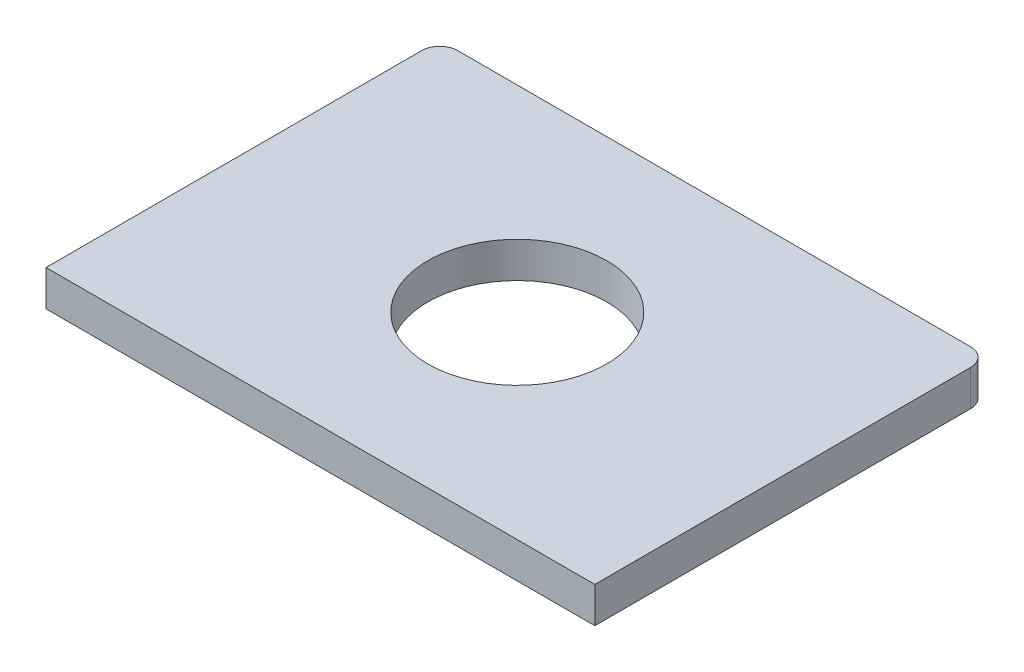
SolidWorks part; units mm, degrees
ref_plane "Plan de face" through (0, 0, 0) normal (0, 0, 1) x (1, 0, 0)
ref_plane "Plan de dessus" through (0, 0, 0) normal (0, 1, 0) x (1, 0, 0)
ref_plane "Plan de droite" through (0, 0, 0) normal (1, 0, 0) x (0, 0, -1)
sketch "Esquisse1" plane through (0, 0, 0) normal (0, 1, 0) x (1, 0, 0)
  circle A0 centre (0, 0) radius 75
  circle A1 centre (0, 0) radius 60
  dimension "D1" = 150
  dimension "D2" = 120
extrude "Boss.-Extru.1" add sketch "Esquisse1" along normal blind 215
sketch "Esquisse2" plane through (0, 215, 0) normal (0, 1, 0) x (1, 0, 0)
  line L0 (142.683, 135) -> (-142.683, 135)
  line L1 (-200, 0) -> (-230, -26.0577)
  line L2 (-230, -26.0577) -> (-230, -165)
  line L3 (-230, -165) -> (-200, -165)
  line L4 (200, 0) -> (230, -32.3018)
  line L5 (230, -32.3018) -> (230, -165)
  line L6 (230, -165) -> (200, -165)
  line L7 (142.683, 135) -> (47.6326, 57.9321)
  line L9 (170, 118.5267) -> (66.5267, 34.6295)
  line L10 (-200, 165) -> (-200, 0)
  line L11 (200, -165) -> (-200, -165)
  line L12 (200, 165) -> (200, 0)
  line L13 (200, 165) -> (-200, 165)
  line L14 (-170, 118.5267) -> (-170, -118.5267)
  line L15 (142.683, -135) -> (-142.683, -135)
  line L16 (170, 118.5267) -> (170, -118.5267)
  line L17 (170, 135) -> (166.5, 135)
  line L18 (-47.6326, -57.9321) -> (-142.683, -135)
  line L20 (142.683, -135) -> (47.6326, -57.9321)
  line L22 (-66.5267, -34.6295) -> (-170, -118.5267)
  line L24 (-66.5267, 34.6295) -> (-170, 118.5267)
  line L28 (-47.6326, 57.9321) -> (-142.683, 135)
  line L30 (170, -118.5267) -> (66.5267, -34.6295)
  circle A0 centre (0, 0) radius 75
  point P0 (0, 0)
  dimension "D1" = 30
  dimension "D2" = 30
extrude "Boss.-Extru.2" add sketch "Esquisse2" along normal blind 30 separate body
sketch "Esquisse3" plane through (0, 215, 0) normal (0, 1, 0) x (1, 0, 0)
  circle A0 centre (0, 0) radius 75
extrude "Boss.-Extru.3" add sketch "Esquisse3" along normal blind 30
sketch "Esquisse4" plane through (0, 245, 0) normal (0, 1, 0) x (1, 0, 0)
  circle A0 centre (0, 0) radius 75
extrude "Enlèv. mat.-Extru.2" cut sketch "Esquisse4" against normal blind 305
sketch "Esquisse5" plane through (0, 0, 165) normal (0, 0, 1) x (1, 0, 0)
  line L0 (-230, 245) -> (-230, 215) construction
  line L1 (-207, 240) -> (-223, 240)
  line L2 (-205, 238) -> (-205, 222)
  line L3 (-207, 220) -> (-223, 220)
  line L4 (-225, 238) -> (-225, 222)
  line L5 (-205, 240) -> (-225, 220) construction
  line L6 (-205, 220) -> (-225, 240) construction
  line L7 (-230, 245) -> (230, 245) construction
  line L8 (230, 245) -> (230, 215) construction
  line L9 (207, 240) -> (223, 240)
  line L10 (205, 238) -> (205, 222)
  line L11 (207, 220) -> (223, 220)
  line L12 (225, 238) -> (225, 222)
  line L13 (205, 240) -> (225, 220) construction
  line L14 (205, 220) -> (225, 240) construction
  arc A0 (-223, 240) -> (-225, 238) centre (-223, 238) ccw
  arc A1 (-223, 220) -> (-225, 222) centre (-223, 222) cw
  arc A2 (-205, 222) -> (-207, 220) centre (-207, 222) cw
  arc A3 (-207, 240) -> (-205, 238) centre (-207, 238) cw
  arc A4 (205, 222) -> (207, 220) centre (207, 222) ccw
  arc A5 (223, 220) -> (225, 222) centre (223, 222) ccw
  arc A6 (223, 240) -> (225, 238) centre (223, 238) cw
  arc A7 (207, 240) -> (205, 238) centre (207, 238) ccw
  point P0 (-215, 230)
  point P9 (215, 230)
  dimension "D9" = 2
  dimension "D1" = 20
  dimension "D2" = 20
  dimension "D3" = 5
  dimension "D4" = 5
  dimension "D5" = 20
  dimension "D6" = 20
  dimension "D7" = 5
  dimension "D8" = 5
extrude "Enlèv. mat.-Extru.3" cut sketch "Esquisse5" against normal blind 80
shell "Coque1" thickness 5
sketch "Esquisse8" plane through (0, 0, 80) normal (0, 0, -1) x (-1, 0, 0)
  line L1 (-225, 240) -> (-199.9468, 240)
  line L2 (-225, 240) -> (-225, 220.0305)
  line L3 (-225, 220.0305) -> (-199.9468, 220.0305)
  line L4 (-199.9468, 240) -> (-199.9468, 220.0305)
extrude "Enlèv. mat.-Extru.4" cut sketch "Esquisse8" against normal blind 80
sketch "Esquisse9" plane through (0, 0, 85) normal (0, 0, -1) x (-1, 0, 0)
  line L0 (207, 240) -> (200.2918, 240) construction
  line L1 (207, 240) -> (199.8445, 240)
  line L2 (207, 240) -> (207, 220)
  line L3 (207, 220) -> (199.8445, 220)
  line L4 (199.8445, 240) -> (199.8445, 220)
  arc A0 (207, 240) -> (205, 238) centre (207, 238) ccw construction
extrude "Enlèv. mat.-Extru.5" cut sketch "Esquisse9" against normal blind 75
sketch "Esquisse10" plane through (0, 245, 0) normal (0, 1, 0) x (1, 0, 0)
  line L0 (230, -32.3018) -> (230, -165) construction
  line L1 (-230, -165) -> (230, -165)
  line L2 (-230, -165) -> (-230, 165)
  line L3 (-230, 165) -> (230, 165)
  line L4 (230, -165) -> (230, 165)
  line L5 (200, 165) -> (-200, 165) construction
  dimension "D1" = 0
  dimension "D2" = 0
extrude "Boss.-Extru.4" add sketch "Esquisse10" against normal blind 30
sketch "Esquisse11" plane through (0, 245, 0) normal (0, 1, 0) x (1, 0, 0)
  circle A0 centre (0, 0) radius 75
  dimension "D1" = 150
extrude "Enlèv. mat.-Extru.6" cut sketch "Esquisse11" against normal blind 30
sketch "Esquisse12" plane through (0, 0, 165) normal (0, 0, 1) x (1, 0, 0)
  line L0 (-230, 245) -> (230, 245) construction
  line L1 (-225, 240) -> (225, 240)
  line L2 (-225, 240) -> (-225, 220)
  line L3 (-225, 220) -> (225, 220)
  line L4 (225, 240) -> (225, 220)
  line L5 (-230, 245) -> (-230, 215) construction
  line L6 (-230, 215) -> (230, 215) construction
  line L7 (230, 245) -> (230, 215) construction
  dimension "D1" = 5
  dimension "D2" = 5
  dimension "D3" = 5
  dimension "D4" = 5
extrude "Enlèv. mat.-Extru.7" cut sketch "Esquisse12" against normal blind 2
shell "Coque2" thickness 5
sketch "Esquisse13" plane through (0, 0, 165) normal (0, 0, 1) x (1, 0, 0)
  line L1 (-225, 240) -> (225, 240)
  line L2 (-225, 240) -> (-225, 220)
  line L3 (-225, 220) -> (225, 220)
  line L4 (225, 240) -> (225, 220)
extrude "Boss.-Extru.5" add sketch "Esquisse13" against normal blind 5
fillet "Congé3" radius 15 2 edges at (-230, 230, -165) (230, 230, -165)
